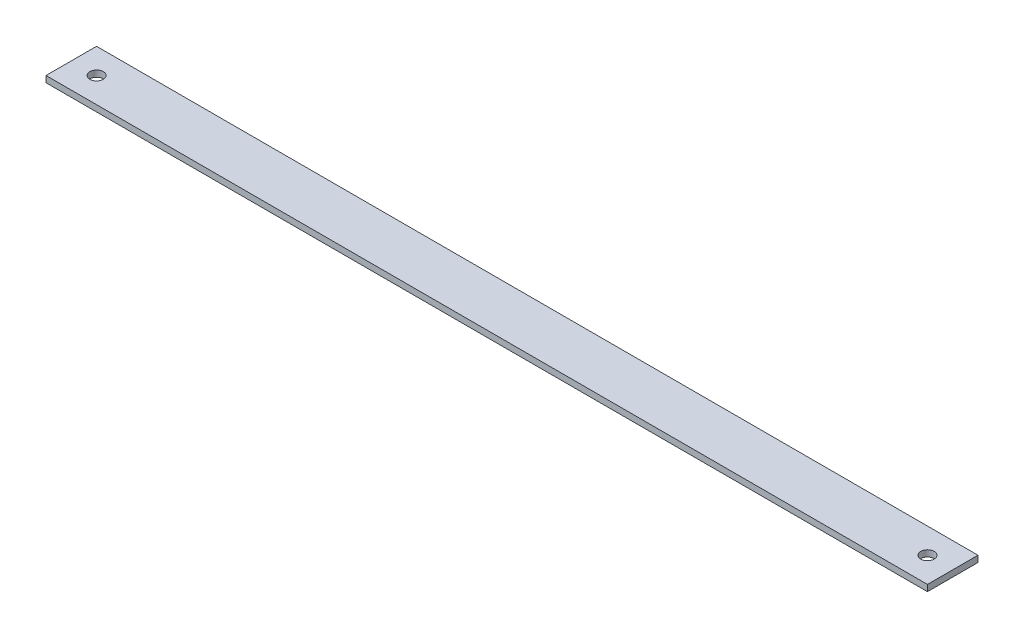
SolidWorks part; units mm, degrees
ref_plane "Front Plane" through (0, 0, 0) normal (0, 0, 1) x (1, 0, 0)
ref_plane "Top Plane" through (0, 0, 0) normal (0, 1, 0) x (1, 0, 0)
ref_plane "Right Plane" through (0, 0, 0) normal (1, 0, 0) x (0, 0, -1)
sketch "Sketch1" plane through (0, 0, 0) normal (0, 1, 0) x (1, 0, 0)
  line L1 (-221.488, 12.7) -> (221.488, 12.7)
  line L2 (-221.488, 12.7) -> (-221.488, -12.7)
  line L3 (-221.488, -12.7) -> (221.488, -12.7)
  line L4 (221.488, 12.7) -> (221.488, -12.7)
  line L5 (-221.488, 12.7) -> (221.488, -12.7) construction
  line L6 (-221.488, -12.7) -> (221.488, 12.7) construction
  point P0 (0, 0)
  dimension "D1" = 442.976
  dimension "D2" = 25.4
extrude "Boss-Extrude1" add sketch "Sketch1" along normal blind 3.175
sketch "Sketch3" plane through (0, 3.175, 0) normal (0, 1, 0) x (1, 0, 0)
  line L0 (-221.488, 0) -> (221.488, 0) construction
  line L1 (-221.488, 12.7) -> (-221.488, -12.7) construction
  line L2 (221.488, -12.7) -> (221.488, 12.7) construction
  line L3 (-221.488, -12.7) -> (221.488, -12.7) construction
  line L4 (-221.488, 12.7) -> (-221.488, -12.7) construction
  line L7 (221.488, -12.7) -> (221.488, 12.7) construction
  circle A0 centre (-208.788, 0) radius 3.3782
  circle A2 centre (208.788, 0) radius 3.3782
  dimension "D3" = 6.7564
  dimension "D4" = 6.7564
  dimension "D5" = 12.7
  dimension "D1" = 12.7
  dimension "D6" = 12.7
extrude "Cut-Extrude1" cut sketch "Sketch3" against normal through all
